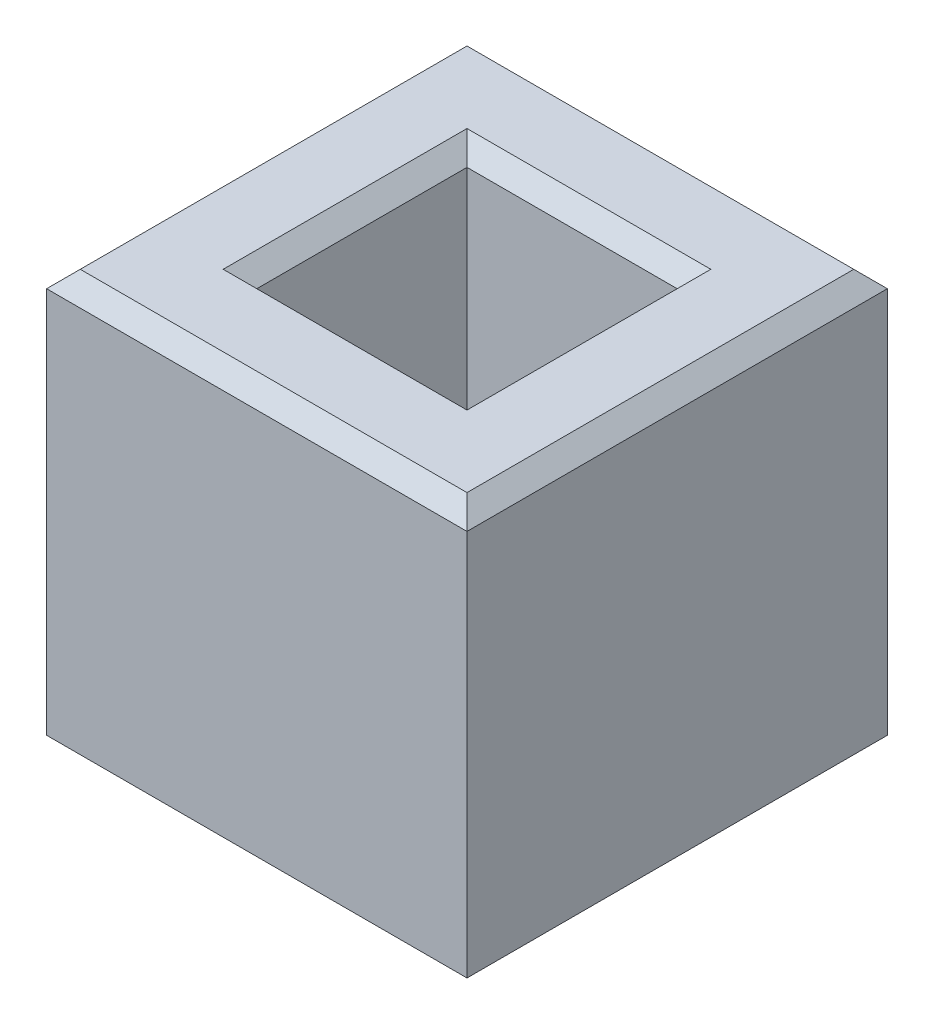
SolidWorks part; units mm, degrees
ref_plane "Front Plane" through (0, 0, 0) normal (0, 0, 1) x (1, 0, 0)
ref_plane "Top Plane" through (0, 0, 0) normal (0, 1, 0) x (1, 0, 0)
ref_plane "Right Plane" through (0, 0, 0) normal (1, 0, 0) x (0, 0, -1)
sketch "Sketch1" plane through (0, 0, 0) normal (0, 1, 0) x (1, 0, 0)
  line L1 (-63.5, -63.5) -> (63.5, -63.5)
  line L2 (-63.5, -63.5) -> (-63.5, 63.5)
  line L3 (-63.5, 63.5) -> (63.5, 63.5)
  line L4 (63.5, -63.5) -> (63.5, 63.5)
  line L5 (-63.5, -63.5) -> (63.5, 63.5) construction
  line L6 (-63.5, 63.5) -> (63.5, -63.5) construction
  point P0 (0, 0)
  dimension "D1" = 127
  dimension "D2" = 127
extrude "Boss-Extrude1" add sketch "Sketch1" along normal blind 127
sketch "Sketch2" plane through (0, 127, 0) normal (0, 1, 0) x (1, 0, 0)
  line L1 (-31.75, -31.75) -> (31.75, -31.75)
  line L2 (-31.75, -31.75) -> (-31.75, 31.75)
  line L3 (-31.75, 31.75) -> (31.75, 31.75)
  line L4 (31.75, -31.75) -> (31.75, 31.75)
  line L5 (-31.75, -31.75) -> (31.75, 31.75) construction
  line L6 (-31.75, 31.75) -> (31.75, -31.75) construction
  point P0 (0, 0)
  dimension "D1" = 63.5
extrude "Cut-Extrude1" cut sketch "Sketch2" against normal through all
chamfer "Chamfer1" distance 5.08 angle 45 16 edges at (0, 0, -63.5) (-63.5, 0, 0) (0, 0, 63.5) (63.5, 0, 0) (0, 0, 31.75) (-31.75, 0, 0) (0, 0, -31.75) (31.75, 0, 0) (0, 127, 63.5) (-63.5, 127, 0) (0, 127, -63.5) (63.5, 127, 0) (-31.75, 127, 0) (0, 127, 31.75) (31.75, 127, 0) (0, 127, -31.75)
